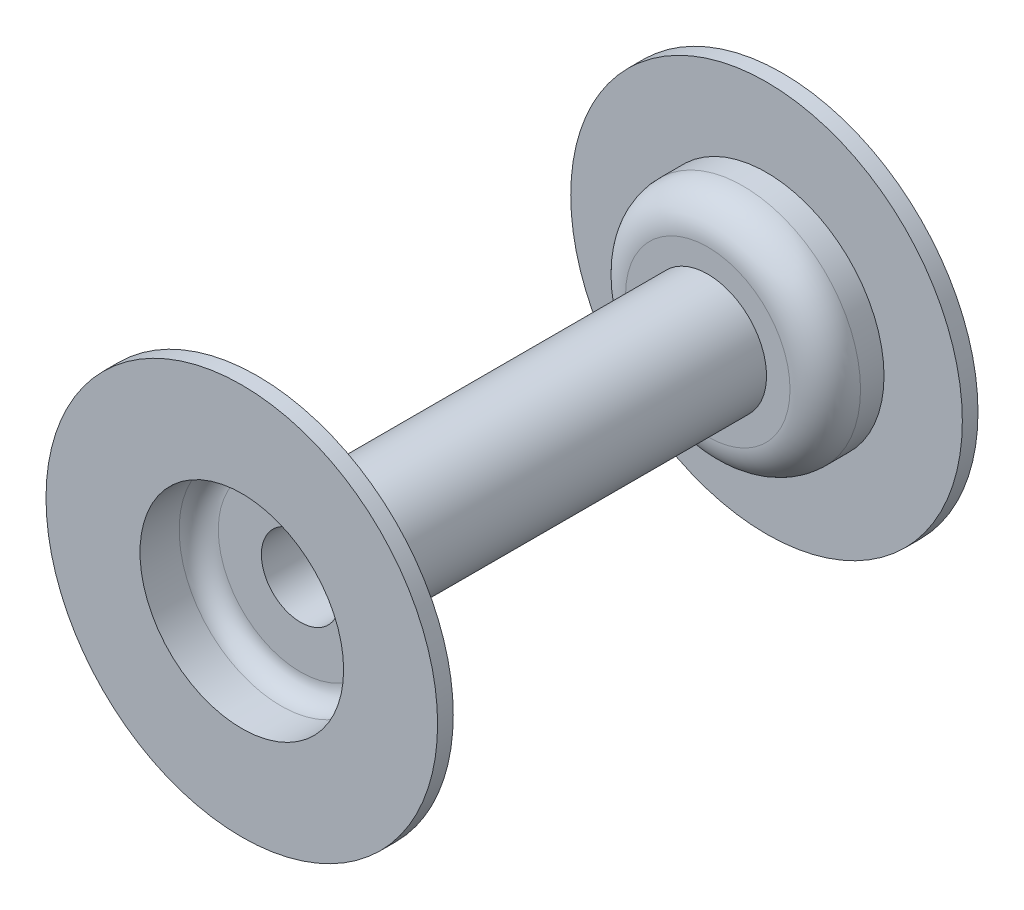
SolidWorks part; units mm, degrees
ref_plane "Front Plane" through (0, 0, 0) normal (0, 0, 1) x (1, 0, 0)
ref_plane "Top Plane" through (0, 0, 0) normal (0, 1, 0) x (1, 0, 0)
ref_plane "Right Plane" through (0, 0, 0) normal (1, 0, 0) x (0, 0, -1)
sketch "Sketch1" plane through (0, 0, 0) normal (0, 0, 1) x (1, 0, 0)
  circle A0 centre (0, 0) radius 7.5
  dimension "D1" = 15
extrude "Boss-Extrude1" add sketch "Sketch1" along normal mid plane 50
sketch "Sketch6" plane through (0, 0, 0) normal (1, 0, 0) x (0, 0, -1)
  line L0 (-32.5, 15) -> (-29.5, 15)
  line L2 (-27, 0) -> (-25, 0)
  line L4 (0, 0) -> (0, 22.3477) construction
  line L5 (0, 8.25) -> (0, -8.25) construction
  line L6 (-25, 0) -> (-25, 10.5)
  line L8 (-27, 0) -> (-27, 10.5)
  line L9 (-25, 0) -> (-25, 22.3477) construction
  line L10 (-32.5, 15) -> (-32.5, 13)
  line L11 (-30.5, 13) -> (-29.5, 13) construction
  line L12 (-27, 2) -> (-27, 10.5) construction
  line L13 (-32.5, 13) -> (-29.5, 13)
  line L14 (-30.5, 13) -> (-30.5, 2) construction
  line L15 (-30.5, 2) -> (-27, 2) construction
  line L16 (-32.5, 15) -> (-32.5, 0) construction
  line L17 (-32.5, 0) -> (-25, 0) construction
  arc A0 (-29.5, 15) -> (-25, 10.5) centre (-29.5, 10.5) cw
  arc A1 (-29.5, 13) -> (-27, 10.5) centre (-29.5, 10.5) cw
  dimension "D2" = 25
  dimension "D1" = 3
  dimension "D3" = 15
  dimension "D4" = 32.5
  dimension "D5" = 2
revolve "Revolve1" add sketch "Sketch6" angle 360
sketch "Sketch2" plane through (0, 0, 32.5) normal (0, 0, 1) x (1, 0, 0)
  circle A0 centre (0, 0) radius 25
  circle A2 centre (0, 0) radius 13
  dimension "D1" = 50
  dimension "D2" = 26
extrude "Boss-Extrude2" add sketch "Sketch2" along normal blind 2
sketch "Sketch5" plane through (0, 0, 34.5) normal (0, 0, 1) x (1, 0, 0)
  line L0 (0, 0) -> (20, 0) construction
  circle A0 centre (0, 0) radius 20 construction
  circle A1 centre (20, 0) radius 0.8
  dimension "D1" = 40
  dimension "D2" = 1.6
mirror "Mirror1" about plane through (0, 0, 0) normal (0, 0, 1) of "Boss-Extrude2", "Revolve1"
sketch "Sketch7" plane through (0, 0, 34.5) normal (0, 0, 1) x (1, 0, 0)
  circle A0 centre (0, 0) radius 5
  dimension "D1" = 10
extrude "Cut-Extrude4" cut sketch "Sketch7" against normal through all
